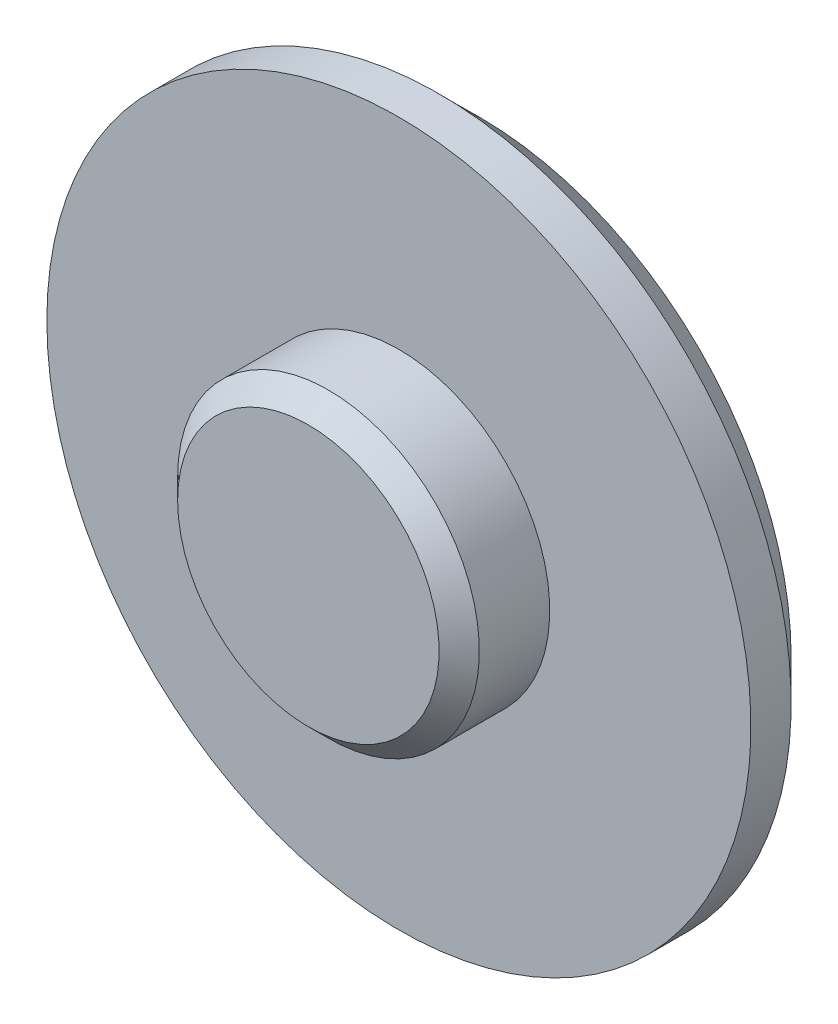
SolidWorks part; units mm, degrees
ref_plane "Спереди" through (0, 0, 0) normal (0, 0, 1) x (1, 0, 0)
ref_plane "Сверху" through (0, 0, 0) normal (0, 1, 0) x (1, 0, 0)
ref_plane "Справа" through (0, 0, 0) normal (1, 0, 0) x (0, 0, -1)
ref_plane "Плоскость1" through (0, 0, 0) normal (0, -1, 0) x (1, 0, 0)
sketch "Эскиз1" plane through (0, 0, 0) normal (0, -1, 0) x (1, 0, 0)
  line L0 (6.5, 8.5) -> (0, 8.5)
  line L1 (0, 8.5) -> (0, 0)
  line L2 (0, 0) -> (15.5, 0)
  line L3 (15.5, 0) -> (17.5, 2)
  line L4 (17.5, 2) -> (17.5, 4)
  line L5 (17.5, 4) -> (7.5, 4)
  line L6 (7.5, 4) -> (7.5, 7.5)
  line L7 (7.5, 7.5) -> (6.5, 8.5)
  line L8 (0, 8.5) -> (0, 0) construction
revolve "Повернуть1" add sketch "Эскиз1" angle 360 about L8
